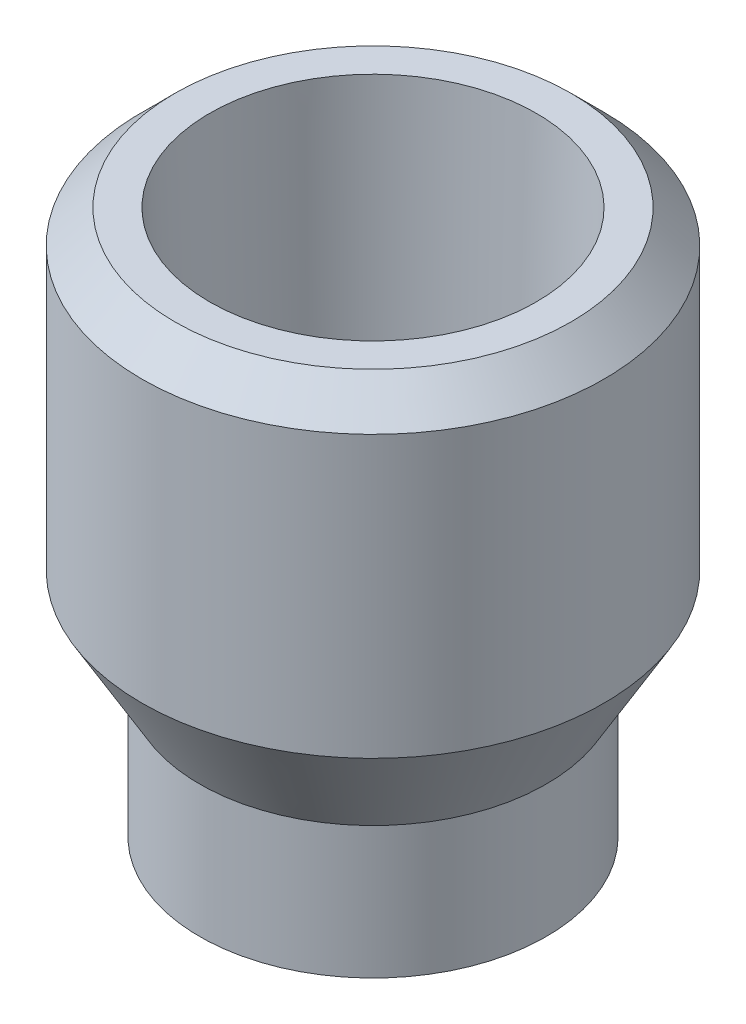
SolidWorks part; units mm, degrees
ref_plane "Přední rovina" through (0, 0, 0) normal (0, 0, 1) x (1, 0, 0)
ref_plane "Horní rovina" through (0, 0, 0) normal (0, 1, 0) x (1, 0, 0)
ref_plane "Pravá rovina" through (0, 0, 0) normal (1, 0, 0) x (0, 0, -1)
sketch "Skica1" plane through (0, 0, 0) normal (0, 1, 0) x (1, 0, 0)
  circle A0 centre (0, 0) radius 14
  dimension "D1" = 28
extrude "Přidat vysunutím1" add sketch "Skica1" along normal blind 33
sketch "Skica2" plane through (0, 0, 0) normal (0, -1, 0) x (1, 0, 0)
  circle A0 centre (0, 0) radius 10.5
  dimension "D1" = 21
extrude "Odebrat vysunutím1" cut sketch "Skica2" against normal blind 14 flip side to cut
chamfer "Zkosení1" distance 3.5 distance2 6 1 edges at (0, 14, -10.5)
chamfer "Zkosení2" distance 2 angle 45 1 edges at (0, 33, 14)
hole_wizard "1/2 sérii závitu1" positions "Skica4" profile "Skica3" size "1/2" standard "ANSI palce"
sketch "Skica4" plane through (0, 33, 0) normal (0, 1, 0) x (-1, 0, 0)
  circle A0 centre (0, 0) radius 12 construction
  point P0 (0, 0)
  dimension "D1" = 0
sketch "Skica3" plane through (0, 33, 0) normal (1, 0, 0) x (0, 0, 1)
  line L0 (0, 0) -> (0, 24.6546)
  line L1 (8.9281, 19.5) -> (0, 24.6546)
  line L2 (-8.9281, 19.5) -> (0, 24.6546) construction
  line L3 (8.9281, 19.5) -> (8.9281, 14)
  line L4 (8.9281, 14) -> (9.4797, 14)
  line L5 (9.4797, 14) -> (9.8989, 0)
  line L6 (-9.4797, 14) -> (-9.8989, 0) construction
  line L7 (9.8989, 0) -> (0, 0)
  line L8 (0, -6.35) -> (0, 107.95) construction
  line L11 (-8.9281, 14) -> (-9.4797, 14) construction
  dimension "Průměr závitníku" = 17.8562
  dimension "Hloubka závitníku" = 19.5
  dimension "Průměr závitu" = 19.7978
  dimension "Úhel závitu" = 3.43
  dimension "Hloubka závitu" = 14
  dimension "Úhel vrtání" = 120
sketch "Skica5" plane through (0, 0, 0) normal (0, -1, 0) x (1, 0, 0)
  circle A0 centre (0, 0) radius 3.5
  dimension "D1" = 7
extrude "Odebrat vysunutím2" cut sketch "Skica5" against normal through all
